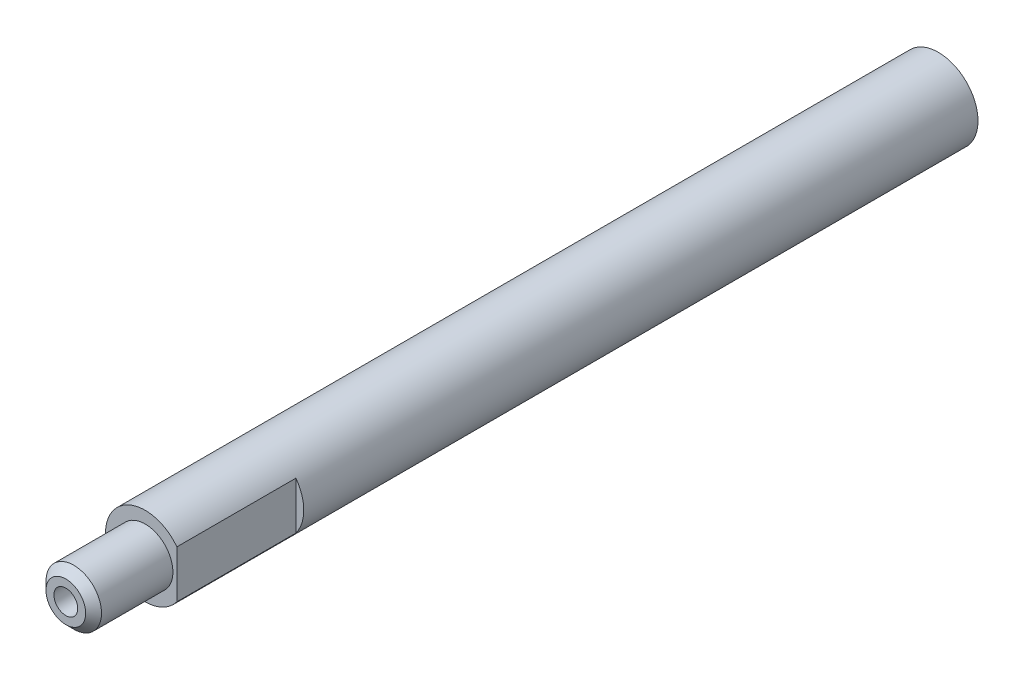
SolidWorks part; units mm, degrees
ref_plane "Front Plane" through (0, 0, 0) normal (0, 0, 1) x (1, 0, 0)
ref_plane "Top Plane" through (0, 0, 0) normal (0, 1, 0) x (1, 0, 0)
ref_plane "Right Plane" through (0, 0, 0) normal (1, 0, 0) x (0, 0, -1)
sketch "Sketch1" plane through (0, 0, 0) normal (0, 0, 1) x (1, 0, 0)
  circle A0 centre (0, 0) radius 5
  dimension "D1" = 10
extrude "Base Extrude" add sketch "Sketch1" along normal blind 110
sketch "Sketch6" plane through (0, 0, 110) normal (0, 0, 1) x (1, 0, 0)
  circle A0 centre (0, 0) radius 3.5
  dimension "D1" = 7
extrude "Front Cut" cut sketch "Sketch6" against normal blind 10 flip side to cut
hole_wizard "Ø3.0 (3) Front Hole" positions "Sketch3" profile "Sketch2" hole size "Ø3.0" standard "ANSI Metric"
sketch "Sketch3" plane through (0, 0, 110) normal (0, 0, 1) x (1, 0, 0)
  point P0 (0, 0)
sketch "Sketch2" plane through (0, 0, 110) normal (1, 0, 0) x (0, -1, 0)
  line L0 (0, 0) -> (0, 10.9013)
  line L1 (0, 10.9013) -> (1.5, 10)
  line L2 (1.5, 10) -> (1.5, 0)
  line L5 (1.5, 0) -> (0, 0)
  line L10 (0, 10.9013) -> (-1.5, 10) construction
  line L11 (0, -6.35) -> (0, 107.95) construction
  dimension "Hole Dia." = 3
  dimension "Hole Depth" = 10
  dimension "Drill Angle" = 118
chamfer "Chamfer1" distance 1 angle 45 1 edges at (3.5, 0, 110)
sketch "Keyway Sketch" plane through (0, 0, 100) normal (0, 0, 1) x (1, 0, 0)
  line L0 (4, 3) -> (4, -3)
  arc A1 (4, -3) -> (4, 3) centre (0, 0) ccw
  circle A2 centre (0, 0) radius 5 construction
  dimension "D1" = 6
extrude "Keyway Cut" cut sketch "Keyway Sketch" against normal blind 15
hole_wizard "Ø4.0 (4) Back Hole" positions "Sketch4" profile "Sketch5" hole size "Ø4.0" standard "ANSI Metric"
sketch "Sketch4" plane through (0, 0, 0) normal (0, 0, -1) x (-1, 0, 0)
  point P0 (0, 0)
sketch "Sketch5" plane through (0, 0, 0) normal (1, 0, 0) x (0, 1, 0)
  line L0 (0, 0) -> (0, 21.2017)
  line L1 (0, 21.2017) -> (2, 20)
  line L2 (2, 20) -> (2, 0)
  line L5 (2, 0) -> (0, 0)
  line L10 (0, 21.2017) -> (-2, 20) construction
  line L11 (0, -6.35) -> (0, 107.95) construction
  dimension "Hole Dia." = 4
  dimension "Hole Depth" = 20
  dimension "Drill Angle" = 118
